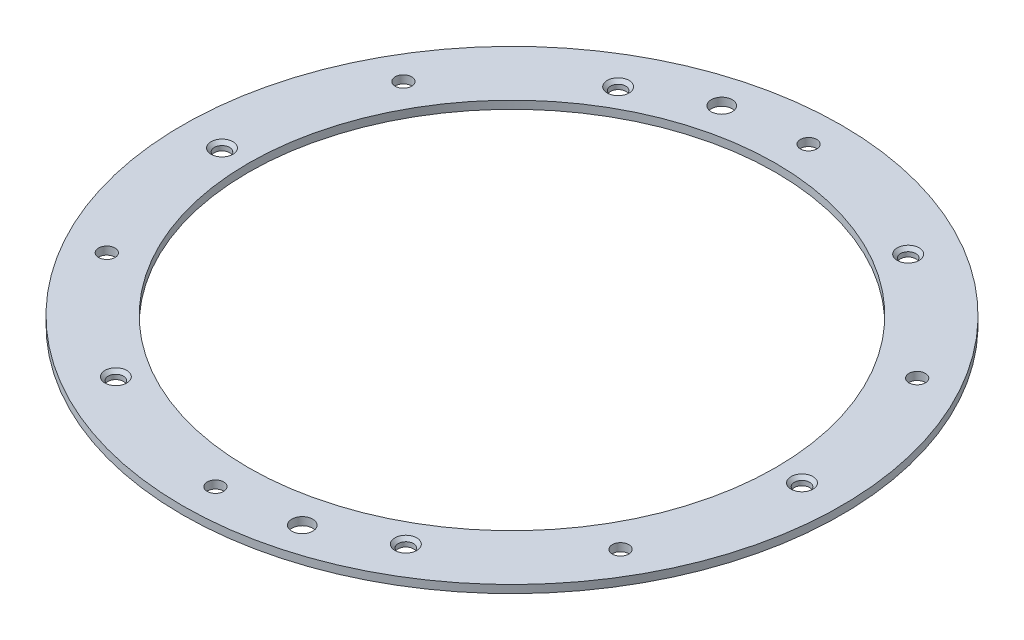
SolidWorks part; units mm, degrees
ref_plane "Front Plane" through (0, 0, 0) normal (0, 0, 1) x (1, 0, 0)
ref_plane "Top Plane" through (0, 0, 0) normal (0, 1, 0) x (1, 0, 0)
ref_plane "Right Plane" through (0, 0, 0) normal (1, 0, 0) x (0, 0, -1)
sketch "Sketch1" plane through (0, 0, 0) normal (0, 1, 0) x (1, 0, 0)
  circle A0 centre (0, 0) radius 63.5
  circle A1 centre (0, 0) radius 50.8
  dimension "D1" = 127
  dimension "D2" = 101.6
extrude "Boss-Extrude1" add sketch "Sketch1" along normal blind 1.524 contours A1
sketch "Sketch2" plane through (0, 1.524, 0) normal (0, 1, 0) x (1, 0, 0)
  line L0 (0, 57.15) -> (0, 0) construction
  line L1 (0, -57.15) -> (0, 0) construction
  line L2 (0, 0) -> (49.4934, -28.575) construction
  line L3 (0, 0) -> (-49.4934, -28.575) construction
  line L4 (0, 0) -> (-49.4934, 28.575) construction
  line L5 (0, 0) -> (49.4934, 28.575) construction
  line L6 (0, 50.8) -> (0, 57.15) construction
  line L7 (0, 57.15) -> (0, 63.5) construction
  circle A0 centre (0, 57.15) radius 1.5875
  circle A1 centre (49.4934, 28.575) radius 1.5875
  circle A2 centre (49.4934, -28.575) radius 1.5875
  circle A3 centre (0, -57.15) radius 1.5875
  circle A4 centre (-49.4934, -28.575) radius 1.5875
  circle A5 centre (-49.4934, 28.575) radius 1.5875
  circle A6 centre (0, 0) radius 57.15 construction
  circle A7 centre (0, 0) radius 50.8 construction
  circle A8 centre (0, 0) radius 63.5 construction
  point P18 (0, 0)
  dimension "D1" = 3.175
  dimension "D3" = 6
extrude "Cut-Extrude1" cut sketch "Sketch2" against normal through all contours A5
sketch "Sketch3" plane through (0, 1.524, 0) normal (0, 1, 0) x (1, 0, 0)
  line L0 (0, 0) -> (0, 57.15) construction
  line L1 (0, 0) -> (-49.4934, 28.575) construction
  line L2 (0, 0) -> (-27.94, 48.3935) construction
  line L3 (-24.7467, 14.2875) -> (-24.7467, 42.8625) construction
  line L4 (-24.7467, 42.8625) -> (0, 28.575) construction
  line L5 (0, 0) -> (27.94, 48.3935) construction
  line L6 (0, 0) -> (55.88, 0) construction
  line L7 (0, 0) -> (27.94, -48.3935) construction
  line L8 (0, 0) -> (-27.94, -48.3935) construction
  line L9 (0, 0) -> (-55.88, 0) construction
  point P18 (0, 0)
  dimension "D2" = 6
  dimension "D1" = 55.88
hole_wizard "#4 Clearance Hole1" positions "Sketch4" profile "Sketch5" hole size "#4" standard "ANSI Inch"
sketch "Sketch4" plane through (0, 1.524, 0) normal (0, 1, 0) x (1, 0, 0)
  point P0 (-27.94, 48.3935)
  point P3 (27.94, 48.3935)
  point P6 (55.88, 0)
  point P9 (27.94, -48.3935)
  point P12 (-27.94, -48.3935)
  point P15 (-55.88, 0)
sketch "Sketch5" plane through (-27.94, 1.524, -48.3935) normal (1, 0, 0) x (0, 0, 1)
  line L0 (0, 0) -> (0, 1.524)
  line L1 (0, 1.524) -> (1.4732, 1.524)
  line L2 (1.4732, 1.524) -> (1.4732, 0.635)
  line L3 (1.4732, 0.635) -> (2.1082, 0)
  line L5 (2.1082, 0) -> (0, 0)
  line L6 (-1.4732, 0.635) -> (-2.1082, 0) construction
  line L11 (0, -6.35) -> (0, 107.95) construction
  dimension "Thru Hole Dia." = 2.9464
  dimension "Thru Hole Depth" = 1.524
  dimension "Near C'Sink Dia." = 4.2164
  dimension "Near C'Sink Angle" = 90
sketch "Sketch6" plane through (0, 1.524, 0) normal (0, 1, 0) x (1, 0, 0)
  line L0 (0, 0) -> (-14.7915, 55.2027) construction
  line L1 (0, 0) -> (14.7915, -55.2027) construction
  line L2 (0, 0) -> (0, 57.15) construction
  line L3 (0, 0) -> (55.88, 0) construction
  circle A0 centre (0, 0) radius 57.15 construction
  dimension "D2" = 114.3
  dimension "D1" = 15
hole_wizard "#10-32 Tapped Hole1" positions "Sketch7" profile "Sketch8" tap size "#10-32" standard "ANSI Inch"
sketch "Sketch7" plane through (0, 1.524, 0) normal (0, 1, 0) x (1, 0, 0)
  point P0 (-14.7915, 55.2027)
  point P3 (14.7915, -55.2027)
sketch "Sketch8" plane through (-14.7915, 1.524, -55.2027) normal (1, 0, 0) x (0, 0, 1)
  line L0 (0, 0) -> (0, 1.524)
  line L1 (0, 1.524) -> (2.0193, 1.524)
  line L2 (2.0193, 1.524) -> (2.0193, 0)
  line L5 (2.0193, 0) -> (0, 0)
  line L11 (0, -6.35) -> (0, 107.95) construction
  dimension "Thru Tap Drill Dia." = 4.0386
  dimension "Thru Tap Drill Depth" = 1.524
sketch "Sketch9" plane through (0, 1.524, 0) normal (0, 1, 0) x (1, 0, 0)
  circle A0 centre (0, 0) radius 50.8
  circle A1 centre (0, 0) radius 50.8 construction
